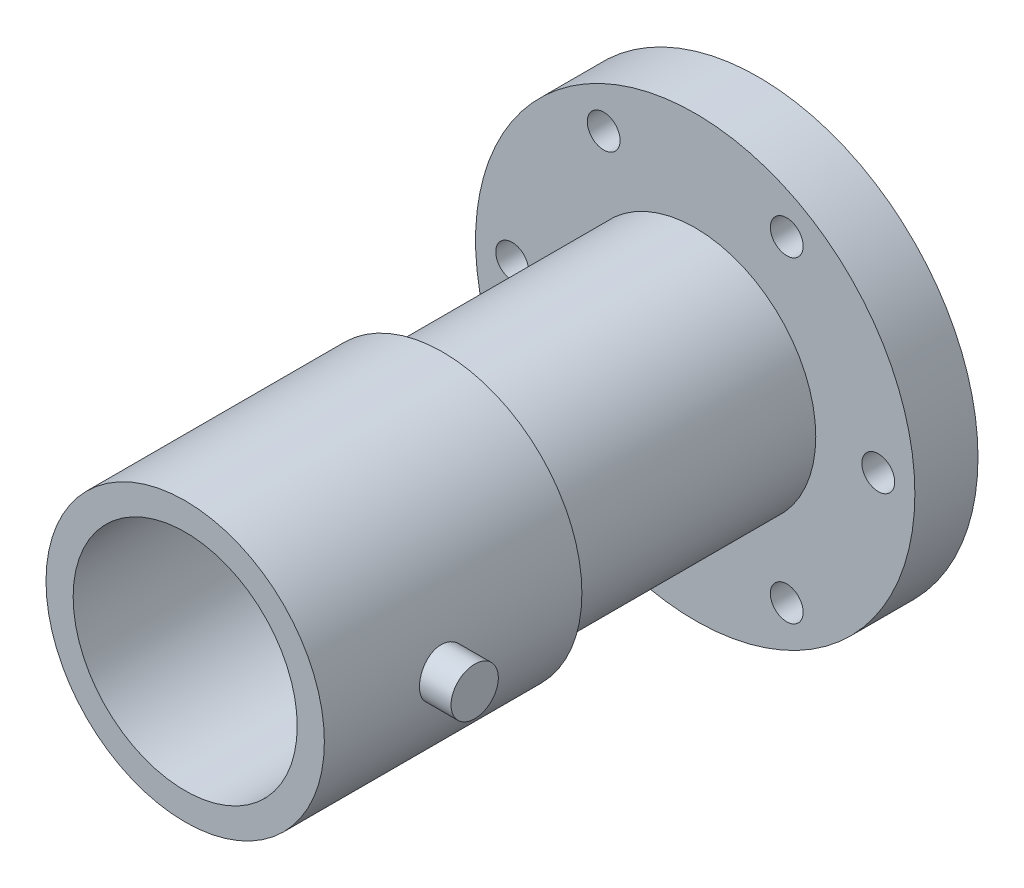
SolidWorks part; units mm, degrees
ref_plane "Front" through (0, 0, 0) normal (0, 0, 1) x (1, 0, 0)
ref_plane "Top" through (0, 0, 0) normal (0, 1, 0) x (1, 0, 0)
ref_plane "Right" through (0, 0, 0) normal (1, 0, 0) x (0, 0, -1)
sketch "Sketch1" plane through (0, 0, 0) normal (0, 0, 1) x (1, 0, 0)
  circle A0 centre (0, 0) radius 44.196
  dimension "D1" = 88.392
extrude "Extrude1" add sketch "Sketch1" along normal blind 12.7
sketch "Sketch2" plane through (0, 0, 12.7) normal (0, 0, 1) x (1, 0, 0)
  circle A0 centre (0, 0) radius 24.257
  dimension "D1" = 48.514
extrude "Extrude2" add sketch "Sketch2" along normal blind 50.8
sketch "Sketch3" plane through (0, 0, 63.5) normal (0, 0, 1) x (1, 0, 0)
  circle A0 centre (0, 0) radius 28.0035
  dimension "D1" = 56.007
extrude "Extrude3" add sketch "Sketch3" along normal blind 51.816
ref_plane "Plane1" through (0, 31.75, 0) normal (0, 1, 0) x (-1, 0, 0)
sketch "Sketch7" plane through (0, 0, 115.316) normal (0, 0, 1) x (1, 0, 0)
  circle A0 centre (0, 0) radius 22.5425
  dimension "D1" = 45.085
extrude "Cut-Extrude2" cut sketch "Sketch7" against normal blind 53.34
sketch "Sketch8" plane through (0, 0, 0) normal (0, 0, -1) x (-1, 0, 0)
  circle A0 centre (-36.83, 0) radius 3.302
  dimension "D1" = 6.604
  dimension "D2" = 36.83
extrude "Cut-Extrude3" cut sketch "Sketch8" against normal through all
pattern_circular "CirPattern4" count 6 over 360 about axis through (0, 0, 0) along (0, 0, 1) of "Cut-Extrude3"
ref_plane "key Plane2" through (28.0035, 0, 0) normal (1, 0, 0) x (0, 0, -1)
sketch "Sketch9" plane through (28.0035, 0, 0) normal (1, 0, 0) x (0, 0, -1)
  line L0 (-115.316, 0) -> (-63.5, 0) construction
  line L1 (-115.316, 28.0035) -> (-115.316, -28.0035) construction
  circle A0 centre (-91.4222, 0) radius 4.7625
  dimension "D1" = 9.525
  dimension "D2" = 23.8938
extrude "Extrude4" add sketch "Sketch9" along normal blind 6.35 and the other way up to surface
